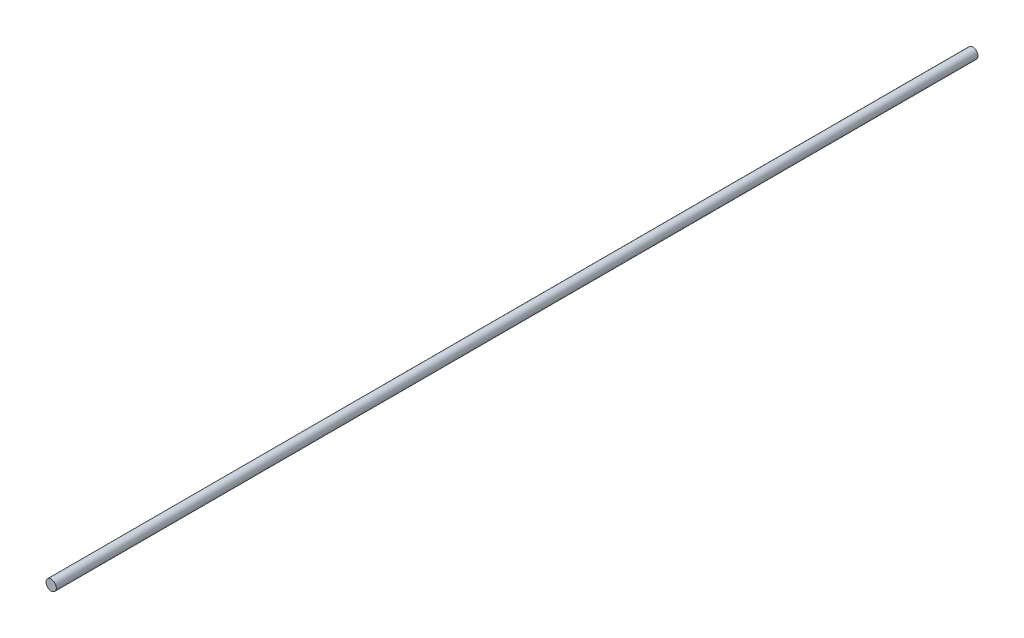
SolidWorks part; units mm, degrees
ref_plane "Front Plane" through (0, 0, 0) normal (0, 0, 1) x (1, 0, 0)
ref_plane "Top Plane" through (0, 0, 0) normal (0, 1, 0) x (1, 0, 0)
ref_plane "Right Plane" through (0, 0, 0) normal (1, 0, 0) x (0, 0, -1)
sketch "Sketch1" plane through (0, 0, 0) normal (0, 0, 1) x (1, 0, 0)
  circle A0 centre (0, 0) radius 30
  dimension "D1" = 60
extrude "Boss-Extrude1" add sketch "Sketch1" against normal blind 5350
